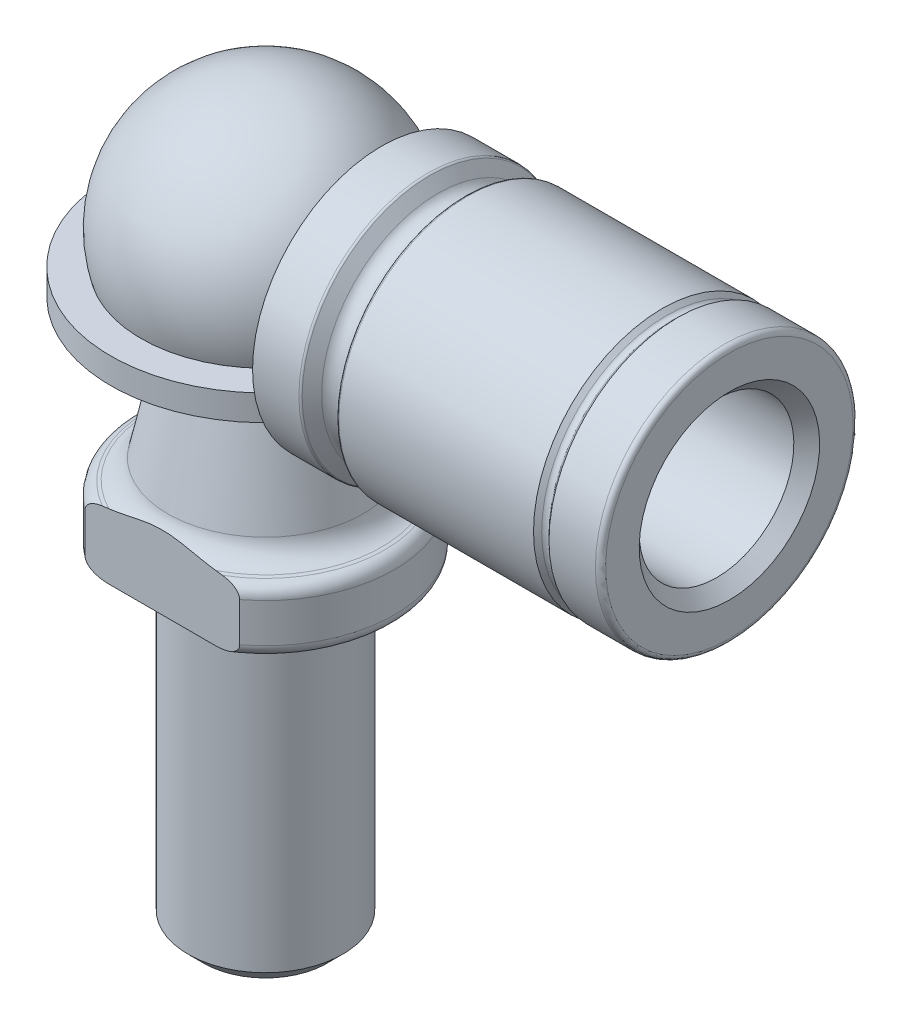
SolidWorks part; units mm, degrees
ref_plane "Plan de face" through (0, 0, 0) normal (0, 0, 1) x (1, 0, 0)
ref_plane "Plan de dessus" through (0, 0, 0) normal (0, 1, 0) x (1, 0, 0)
ref_plane "Plan de droite" through (0, 0, 0) normal (1, 0, 0) x (0, 0, -1)
sketch "Esquisse1" plane through (0, 0, 0) normal (0, 0, 1) x (1, 0, 0)
  line L0 (0, 0) -> (1.5011, 2.6)
  line L1 (1.5011, 2.6) -> (3.5011, 2.6)
  line L2 (3.5011, 2.6) -> (3.9011, 3)
  line L3 (3.9011, 3) -> (11.4011, 3)
  line L4 (11.9011, 3.5) -> (11.9011, 4.8)
  line L5 (11.7011, 5) -> (9.9011, 5)
  line L6 (1.6655, 4.95) -> (1.4346, 4.55)
  line L7 (0.592, 4.5132) -> (0.281, 4.9574)
  line L8 (0.1991, 5) -> (-1.5989, 5)
  line L9 (-6.0989, 6.5) -> (-6.0989, -1) construction
  line L10 (-6.0989, 0) -> (-1.0989, 0) construction
  line L11 (11.4011, 3) -> (11.9011, 3.5)
  line L12 (-1.0989, 0) -> (0, 0)
  line L13 (-1.5989, 5) -> (-1.5989, 2.1794)
  line L14 (9.9011, 5) -> (9.7425, 4.8414)
  line L15 (9.4597, 4.8414) -> (9.3011, 5)
  line L16 (9.3011, 5) -> (1.7521, 5)
  circle A0 centre (-6.0989, -1) radius 7.5 construction
  arc A1 (1.4346, 4.55) -> (0.592, 4.5132) centre (1.0015, 4.8) cw
  arc A2 (-1.0989, 0) -> (-1.5989, 2.1794) centre (-6.0989, 0) ccw
  arc A3 (1.7521, 5) -> (1.6655, 4.95) centre (1.7521, 4.9) ccw
  arc A4 (0.281, 4.9574) -> (0.1991, 5) centre (0.1991, 4.9) ccw
  arc A5 (11.9011, 4.8) -> (11.7011, 5) centre (11.7011, 4.8) ccw
  arc A6 (9.7425, 4.8414) -> (9.4597, 4.8414) centre (9.6011, 4.9828) cw
  point P5 (11.9011, 3)
  point P23 (0.2511, 5)
  point P33 (9.6011, 4.7)
  dimension "D10" = 0.5
  dimension "D18" = 0.1
  dimension "D19" = 0.2
  dimension "D24" = 0.2
  dimension "D13" = 0.2
  dimension "D14" = 30
  dimension "D15" = 18
  dimension "D21" = 45
revolve "Révolution1" add sketch "Esquisse1" angle 360 about L10
sketch "Esquisse2" plane through (0, 0, 0) normal (0, 0, 1) x (1, 0, 0)
  line L0 (-6.0989, 6.5) -> (-6.0989, -1) construction
  line L1 (-1.0989, 0) -> (-1.0989, -1.3)
  line L2 (-0.4989, -5) -> (0.19, -5)
  line L3 (-1.0989, -1.3) -> (-0.0989, -1.3)
  line L4 (-0.0989, -1.3) -> (-0.0989, -2.3)
  line L5 (-0.0989, -2.3) -> (-0.5989, -2.3)
  line L6 (-0.5989, -2.3) -> (-0.5989, -4.9)
  line L7 (-6.0989, 5) -> (-6.0989, 6.5)
  circle A0 centre (-6.0989, -1) radius 7.5 construction
  arc A1 (0.275, -4.9527) -> (-6.0989, 6.5) centre (-6.0989, -1) ccw
  arc A2 (-1.0989, 0) -> (-1.5989, 2.1794) centre (-6.0989, 0) ccw construction
  arc A3 (-1.0989, 0) -> (-6.0989, 5) centre (-6.0989, 0) ccw
  arc A4 (0.19, -5) -> (0.275, -4.9527) centre (0.19, -4.9) ccw
  arc A5 (-0.5989, -4.9) -> (-0.4989, -5) centre (-0.4989, -4.9) ccw
  dimension "D5" = 0.1
  dimension "D1" = 5.5
  dimension "D2" = 1
  dimension "D3" = 1.3
  dimension "D4" = 0.5
sketch "Esquisse5" plane through (0, 0, 0) normal (0, 0, 1) x (1, 0, 0)
  line L0 (-6.0989, 5) -> (-6.0989, -23.5)
  line L1 (-6.0989, -23.5) -> (-8.4989, -23.5)
  line L2 (-9.0989, -22.9) -> (-9.0989, -15.6)
  line L6 (-9.0989, -15.6) -> (-9.0989, -11)
  line L7 (-9.0989, -11) -> (-10.5989, -11)
  line L8 (-11.0989, -10.5) -> (-11.0989, -8.9837)
  line L9 (-10.7283, -8.5007) -> (-10.6068, -8.4682)
  line L10 (-9.8875, -7.7101) -> (-9.1631, -4.3021)
  line L11 (-8.4989, -23.5) -> (-9.0989, -22.9)
  arc A0 (-6.0989, 5) -> (-9.3291, -3.8165) centre (-6.0989, 0) ccw
  arc A1 (-11.0989, -8.9837) -> (-10.7283, -8.5007) centre (-10.5989, -8.9837) cw
  arc A2 (-10.6068, -8.4682) -> (-9.8875, -7.7101) centre (-10.8657, -7.5022) ccw
  arc A3 (-9.3291, -3.8165) -> (-9.1631, -4.3021) centre (-9.6522, -4.1981) cw
  arc A5 (-10.5989, -11) -> (-11.0989, -10.5) centre (-10.5989, -10.5) cw
  point P6 (-9.0989, -23.5)
  point P17 (-11.0989, -8.6)
  point P22 (-9.0989, -4)
  point P28 (-11.0989, -11)
  dimension "D14" = 0.5
  dimension "D15" = 1
  dimension "D16" = 0.5
  dimension "D17" = 0.5
  dimension "D1" = 11
  dimension "D2" = 12.5
  dimension "D3" = 15
  dimension "D4" = 12
  dimension "D5" = 5
  dimension "D6" = 2.4
  dimension "D9" = 4.6
  dimension "D10" = 3
  dimension "D12" = 5
  dimension "D13" = 3
revolve "Révolution3" add sketch "Esquisse5" angle 360 about L0
sketch "Esquisse7" plane through (0, -11, 0) normal (0, -1, 0) x (1, 0, 0)
  line L0 (1.4011, 0) -> (-13.5989, 0) construction
  line L1 (-20.9645, 14.0673) -> (2.1599, 14.0673)
  line L2 (-20.9645, 14.0673) -> (-20.9645, 4)
  line L3 (-20.9645, 4) -> (2.1599, 4)
  line L4 (2.1599, 14.0673) -> (2.1599, 4)
  line L5 (2.1599, -4) -> (-22.2513, -4)
  line L6 (2.1599, -4) -> (2.1599, -9.1093)
  line L7 (2.1599, -9.1093) -> (-22.2513, -9.1093)
  line L8 (-22.2513, -4) -> (-22.2513, -9.1093)
  dimension "D1" = 4
  dimension "D2" = 8
extrude "Enlèv. mat.-Extru.2" cut sketch "Esquisse7" against normal blind 5.5
sketch "Esquisse11" plane through (0, 0, 0) normal (0, 0, 1) x (1, 0, 0)
  line L6 (-6.0989, -11) -> (-6.0989, -19.1923) construction
  line L7 (-8.1604, -11) -> (-4.0373, -11) construction
  line L9 (-0.0989, -1.3) -> (-1.2708, -1.3)
  line L10 (-0.0989, -1.3) -> (-0.0989, -2.3)
  line L11 (-0.0989, -2.3) -> (-1.3418, -2.3)
  arc A2 (-1.5248, -2.0192) -> (-1.2708, -1.3) centre (-6.0989, 0) ccw
  arc A3 (-1.5248, -2.0192) -> (-1.3418, -2.3) centre (-1.3418, -2.1) ccw
  dimension "D5" = 0.2
  dimension "D4" = 1
revolve "Révolution5" add sketch "Esquisse11" angle 360 about L6
